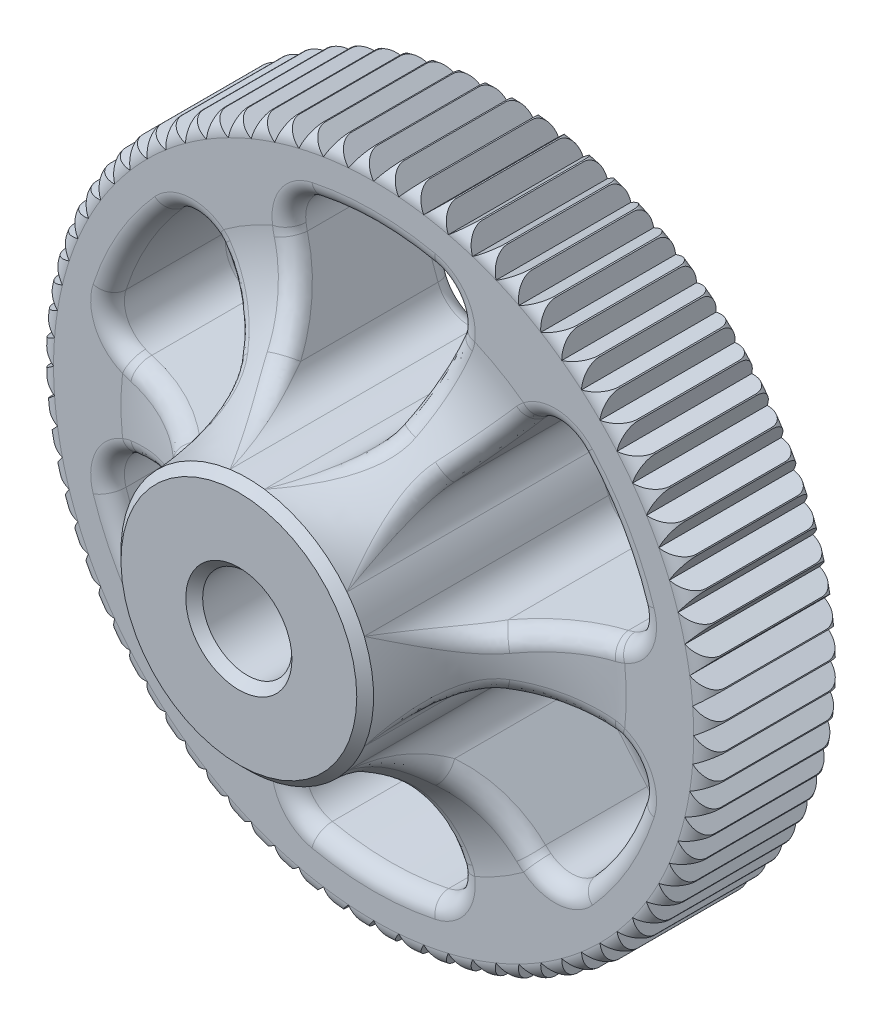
SolidWorks part; units mm, degrees
ref_plane "Płaszczyzna przednia" through (0, 0, 0) normal (0, 0, 1) x (1, 0, 0)
ref_plane "Płaszczyzna górna" through (0, 0, 0) normal (0, 1, 0) x (1, 0, 0)
ref_plane "Płaszczyzna prawa" through (0, 0, 0) normal (1, 0, 0) x (0, 0, -1)
sketch "Szkic1" plane through (0, 0, 0) normal (0, 0, 1) x (1, 0, 0)
  line L1 (0, 4.6765) -> (-4.05, 2.3383) construction
  line L2 (-4.05, 2.3383) -> (-4.05, -2.3383) construction
  line L3 (-4.05, -2.3383) -> (0, -4.6765) construction
  line L4 (0, -4.6765) -> (4.05, -2.3383) construction
  line L5 (4.05, -2.3383) -> (4.05, 2.3383) construction
  line L6 (4.05, 2.3383) -> (0, 4.6765) construction
  circle A0 centre (0, 0) radius 4.05 construction
  circle A1 centre (0, 0) radius 20
  circle A2 centre (0, 0) radius 2.65
  dimension "D2" = 40
  dimension "D3" = 5.3
  dimension "D1" = 8.1
extrude "Dodanie-wyciągnięcie1" add sketch "Szkic1" along normal blind 8
sketch "Szkic2" plane through (0, 0, 8) normal (0, 0, 1) x (1, 0, 0)
  circle A0 centre (0, 0) radius 7.5
  circle A1 centre (0, 0) radius 2.65 construction
  circle A2 centre (0, 0) radius 2.65
  dimension "D1" = 15
extrude "Dodanie-wyciągnięcie2" add sketch "Szkic2" along normal blind 8
sketch "Szkic3" plane through (0, 0, 0) normal (0, 0, -1) x (-1, 0, 0)
  line L1 (4.05, 2.3383) -> (0, 4.6765)
  line L2 (0, 4.6765) -> (-4.05, 2.3383)
  line L3 (-4.05, 2.3383) -> (-4.05, -2.3383)
  line L4 (-4.05, -2.3383) -> (0, -4.6765)
  line L5 (0, -4.6765) -> (4.05, -2.3383)
  line L6 (4.05, -2.3383) -> (4.05, 2.3383)
  circle A0 centre (0, 0) radius 4.05 construction
  dimension "D1" = 8.1
extrude "Wytnij-wyciągnięcie1" cut sketch "Szkic3" against normal blind 6
fillet "Zaokrąglenie1" radius 7.5 1 edges at (7.5, 0, 8)
sketch "Szkic4" plane through (0, 0, 0) normal (0, 0, -1) x (-1, 0, 0)
  line L0 (-5.6433, 15.5049) -> (-2.5652, 7.0477)
  line L1 (5.6433, 15.5049) -> (2.5652, 7.0477)
  line L2 (0, 0) -> (0, 16.5) construction
  arc A0 (5.6433, 15.5049) -> (-5.6433, 15.5049) centre (0, 0) ccw
  arc A1 (2.5652, 7.0477) -> (-2.5652, 7.0477) centre (0, 0) ccw
  dimension "D1" = 33
  dimension "D2" = 15
  dimension "D3" = 40
extrude "Wytnij-wyciągnięcie2" cut sketch "Szkic4" against normal through all
pattern_circular "Szyk kołowy1" count 6 over 360 about axis through (0, 0, 0) along (0, 0, 1) of "Wytnij-wyciągnięcie2"
fillet "Zaokrąglenie3" radius 1 2 edges at (20, 0, 0) (20, 0, 8)
sketch "Szkic5" plane through (0, 0, 8) normal (0, 0, 1) x (1, 0, 0)
  line L0 (-0.75, 19.9859) -> (0, 19)
  line L1 (0, 19) -> (0.75, 19.9859)
  circle A0 centre (0, 0) radius 20 construction
  arc A1 (0.75, 19.9859) -> (-0.75, 19.9859) centre (0, 0) ccw
  dimension "D1" = 19
  dimension "D2" = 1.5
extrude "Wytnij-wyciągnięcie3" cut sketch "Szkic5" against normal through all
pattern_circular "Szyk kołowy2" count 80 over 360 about axis through (0, 0, 0) along (0, 0, 1) of "Wytnij-wyciągnięcie3"
fillet "Zaokrąglenie4" radius 2 36 edges at (15.5107, -2.735, 8) (10.1239, -12.0652, 8) (10.606, -12.6397, 4) (16.2493, -2.8652, 4) (7.3861, -1.3024, 7.75) (4.8209, -5.7453, 7.75) (-10.1239, -12.0652, 8) (-15.5107, -2.735, 8) (-16.2493, -2.8652, 4) (-10.606, -12.6397, 4) (-4.8209, -5.7453, 7.75) (-7.3861, -1.3024, 7.75) (-15.5107, 2.735, 8) (-10.1239, 12.0652, 8) (-10.606, 12.6397, 4) (-16.2493, 2.8652, 4) (-7.3861, 1.3024, 7.75) (-4.8209, 5.7453, 7.75) (10.1239, 12.0652, 8) (15.5107, 2.735, 8) (16.2493, 2.8652, 4) (10.606, 12.6397, 4) (4.8209, 5.7453, 7.75) (7.3861, 1.3024, 7.75) (-5.3868, 14.8002, 8) (5.3868, 14.8002, 8) (5.6433, 15.5049, 4) (-5.6433, 15.5049, 4) (-2.5652, 7.0477, 7.75) (2.5652, 7.0477, 7.75) (5.3868, -14.8002, 8) (-5.3868, -14.8002, 8) (-5.6433, -15.5049, 4) (5.6433, -15.5049, 4) (2.5652, -7.0477, 7.75) (-2.5652, -7.0477, 7.75)
fillet "Zaokrąglenie5" radius 1 102 edges at (2.3294, -7.6981, 0) (0, -7.5, 0) (-2.3294, -7.6981, 0) (-4.0441, -11.1112, 0) (-4.7824, -15.1479, 0) (0, -16.5, 0) (4.7824, -15.1479, 0) (-7.8314, -1.8318, 0) (-11.6446, -2.0533, 0) (-15.5096, -3.4323, 0) (-14.2894, -8.25, 0) (-10.7273, -11.7156, 0) (-7.6005, -9.0579, 0) (-5.5021, -5.8663, 0) (-10.7273, 11.7156, 0) (-14.2894, 8.25, 0) (-15.5096, 3.4323, 0) (-11.6446, 2.0533, 0) (-7.8314, 1.8318, 0) (-6.4952, 3.75, 0) (-5.5021, 5.8663, 0) (4.0441, 11.1112, 0) (2.3294, 7.6981, 0) (0, 7.5, 0) (-2.3294, 7.6981, 0) (-4.0441, 11.1112, 0) (-4.7824, 15.1479, 0) (0, 16.5, 0) (11.6446, 2.0533, 0) (7.8314, 1.8318, 0) (6.4952, 3.75, 0) (5.5021, 5.8663, 0) (7.6005, 9.0579, 0) (10.7273, 11.7156, 0) (14.2894, 8.25, 0) (15.5096, -3.4323, 0) (11.6446, -2.0533, 0) (7.8314, -1.8318, 0) (6.4952, -3.75, 0) (5.5021, -5.8663, 0) (7.6005, -9.0579, 0) (10.7273, -11.7156, 0) (-5.5579, -6.2995, 11.9362) (-8.2345, -1.6635, 11.9362) (-11.3902, -2.0084, 8.8324) (-15.6538, -3.7229, 8) (-14.2894, -8.25, 8) (-11.0511, -11.6951, 8) (2.6766, -7.963, 11.9362) (3.9558, -10.8684, 8.8324) (4.6027, -15.4181, 8) (0, -16.5, 8) (-4.6027, -15.4181, 8) (-2.6766, -7.963, 11.9362) (-8.2345, 1.6635, 11.9362) (-11.3902, 2.0084, 8.8324) (-15.6538, 3.7229, 8) (-14.2894, 8.25, 8) (-11.0511, 11.6951, 8) (-5.5579, 6.2995, 11.9362) (2.6766, 7.963, 11.9362) (3.9558, 10.8684, 8.8324) (4.6027, 15.4181, 8) (0, 16.5, 8) (-4.6027, 15.4181, 8) (-3.9558, 10.8684, 8.8324) (5.5579, 6.2995, 11.9362) (7.4344, 8.86, 8.8324) (11.0511, 11.6951, 8) (14.2894, 8.25, 8) (15.6538, 3.7229, 8) (11.3902, 2.0084, 8.8324) (8.2345, -1.6635, 11.9362) (11.3902, -2.0084, 8.8324) (15.6538, -3.7229, 8) (14.2894, -8.25, 8) (11.0511, -11.6951, 8) (5.5579, -6.2995, 11.9362) (4.0441, -11.1112, 0) (-6.4952, -3.75, 0) (-7.6005, 9.0579, 0) (4.7824, 15.1479, 0) (15.5096, 3.4323, 0) (14.2894, -8.25, 0) (-7.4344, -8.86, 8.8324) (-3.9558, -10.8684, 8.8324) (-7.4344, 8.86, 8.8324) (-2.6766, 7.963, 11.9362) (8.2345, 1.6635, 11.9362) (7.4344, -8.86, 8.8324)
chamfer "Sfazowanie1" distance 0.5 angle 45 6 edges at (2.025, 3.5074, 0) (-2.025, 3.5074, 0) (-4.05, 0, 0) (-2.025, -3.5074, 0) (2.025, -3.5074, 0) (4.05, 0, 0)
chamfer "Sfazowanie2" distance 0.65 angle 65 1 edges at (-2.65, 0, 6)
chamfer "Sfazowanie3" distance 0.5 angle 45 2 edges at (2.65, 0, 16) (7.5, 0, 16)
